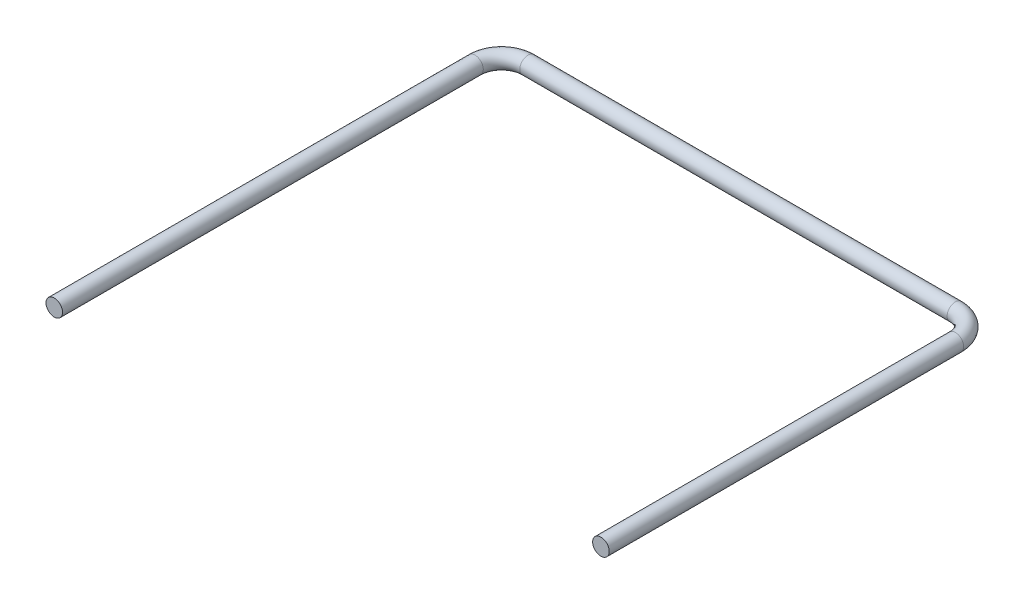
SolidWorks part; units mm, degrees
ref_plane "Front Plane" through (0, 0, 0) normal (0, 0, 1) x (1, 0, 0)
ref_plane "Top Plane" through (0, 0, 0) normal (0, 1, 0) x (1, 0, 0)
ref_plane "Right Plane" through (0, 0, 0) normal (1, 0, 0) x (0, 0, -1)
sketch "Sketch1" plane through (0, 0, 0) normal (0, 1, 0) x (1, 0, 0)
  line L0 (-42.3501, -2.858) -> (-42.3501, 37.4645)
  line L1 (-39.8101, 40.0045) -> (1.1474, 40.0045)
  line L2 (3.6874, 37.4645) -> (3.6874, 3.492)
  arc A0 (-39.8101, 40.0045) -> (-42.3501, 37.4645) centre (-39.8101, 37.4645) ccw
  arc A1 (3.6874, 37.4645) -> (1.1474, 40.0045) centre (1.1474, 37.4645) ccw
  point P6 (-42.3501, 40.0045)
  point P9 (3.6874, 40.0045)
  dimension "D4" = 2.54
  dimension "D1" = 42.8625
  dimension "D2" = 46.0375
  dimension "D3" = 36.5125
curve "CompCurve1"
ref_plane "Plane1" through (-42.3501, 0, 2.858) normal (0, 0, -1) x (-1, 0, 0)
sketch "Sketch2" plane through (-42.3501, 0, 2.858) normal (0, 0, -1) x (-1, 0, 0)
  circle A0 centre (0.0019, 0) radius 0.7937
  dimension "D1" = 1.5875
sweep "Sweep1" add profiles "Sketch2" path "CompCurve1"
